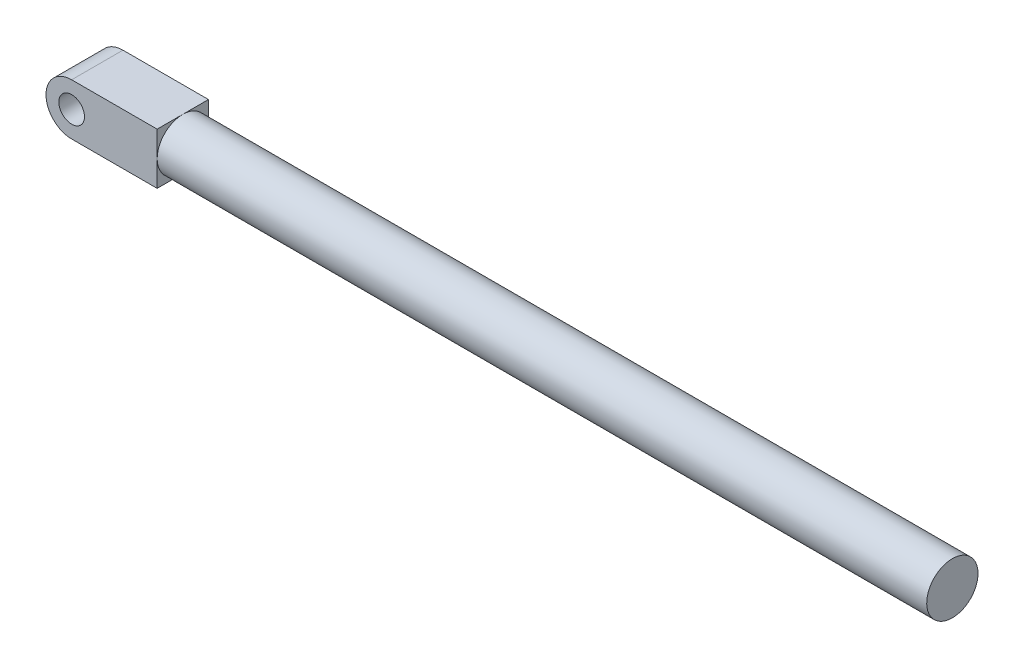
SolidWorks part; units mm, degrees
ref_plane "Plan1" through (0, 0, 0) normal (0, 0, 1) x (1, 0, 0)
ref_plane "Plan2" through (0, 0, 0) normal (0, 1, 0) x (1, 0, 0)
ref_plane "Plan3" through (0, 0, 0) normal (1, 0, 0) x (0, 0, -1)
sketch "Esquisse1" plane through (0, 0, 0) normal (0, 0, 1) x (1, 0, 0)
  line L0 (0, 1.5) -> (5, 1.5)
  line L1 (0, -1.5) -> (5, -1.5)
  line L2 (5, 1.5) -> (5, -1.5)
  arc A0 (0, 1.5) -> (0, -1.5) centre (0, 0) ccw
  circle A1 centre (0, 0) radius 0.75
  dimension "D1" = 3
  dimension "D3" = 1.5
  dimension "D2" = 5
extrude "Base-Extrusion" add sketch "Esquisse1" along normal blind 3
sketch "Esquisse2" plane through (5, 0, 0) normal (1, 0, 0) x (0, 0, -1)
  line L0 (-3, -1.5) -> (0, -1.5) construction
  line L1 (-3, -1.5) -> (-3, 1.5) construction
  circle A0 centre (-1.5, 0) radius 1.5
  dimension "D2" = 3
  dimension "D1" = 1.5
extrude "Boss.-Extru.1" add sketch "Esquisse2" along normal blind 45
